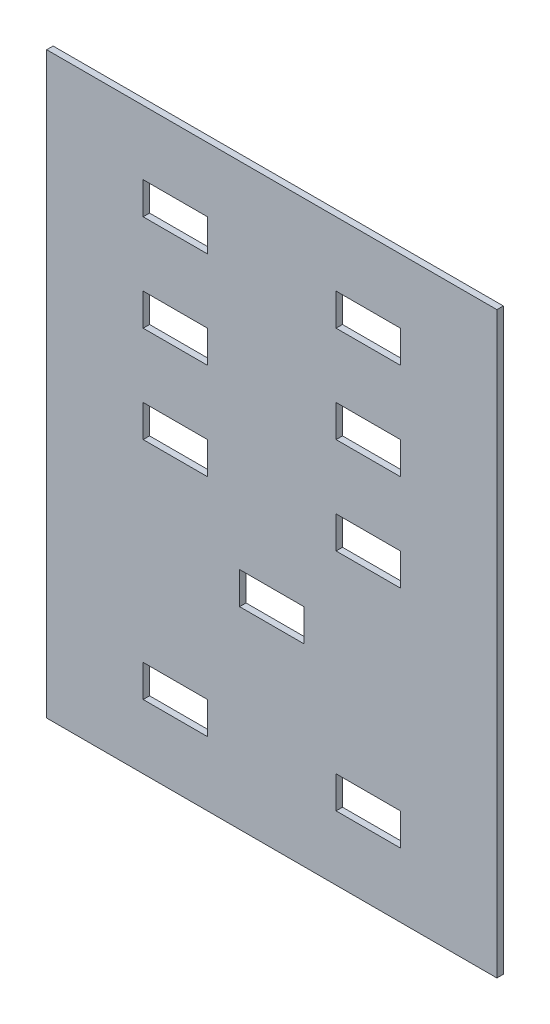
SolidWorks part; units mm, degrees
ref_plane "Front Plane" through (0, 0, 0) normal (0, 0, 1) x (1, 0, 0)
ref_plane "Top Plane" through (0, 0, 0) normal (0, 1, 0) x (1, 0, 0)
ref_plane "Right Plane" through (0, 0, 0) normal (1, 0, 0) x (0, 0, -1)
sketch "Sketch1" plane through (0, 0, 0) normal (0, 0, 1) x (1, 0, 0)
  line L1 (0, 0) -> (350, 0)
  line L2 (0, 0) -> (0, 450)
  line L3 (0, 450) -> (350, 450)
  line L4 (350, 0) -> (350, 450)
  dimension "D1" = 350
  dimension "D2" = 450
extrude "Boss-Extrude1" add sketch "Sketch1" along normal blind 5
sketch "Sketch2" plane through (0, 0, 5) normal (0, 0, 1) x (1, 0, 0)
  line L2 (75, 375) -> (125, 375)
  line L3 (75, 375) -> (75, 400)
  line L4 (75, 400) -> (125, 400)
  line L5 (350, 450) -> (0, 450) construction
  line L6 (175, 450) -> (175, 207.535) construction
  line L7 (125, 375) -> (125, 400)
  line L8 (75, 375) -> (125, 400) construction
  line L9 (75, 400) -> (125, 375) construction
  point P0 (100, 387.5)
  dimension "D1" = 150
  dimension "D2" = 50
  dimension "D3" = 25
  dimension "D4" = 50
extrude "Cut-Extrude1" cut sketch "Sketch2" against normal through all
sketch "Sketch3" plane through (0, 0, 5) normal (0, 0, 1) x (1, 0, 0)
  line L0 (125, 387.5) -> (362.4149, 387.5) construction
  line L2 (125, 375) -> (125, 400) construction
  line L3 (100, 375) -> (100, 353.9352) construction
  line L4 (75, 375) -> (125, 375) construction
  point P8 (250, 387.5)
  point P9 (250, 312.5)
  point P10 (100, 312.5)
  point P11 (100, 237.5)
  point P13 (250, 237.5)
  point P14 (175, 162.5)
  point P15 (100, 62.5)
  point P16 (250, 62.5)
  dimension "D1" = 75
  dimension "D2" = 150
  dimension "D3" = 75
  dimension "D4" = 150
  dimension "D5" = 225
  dimension "D6" = 325
pattern_sketch "Sketch-Pattern1" of "Cut-Extrude1"
